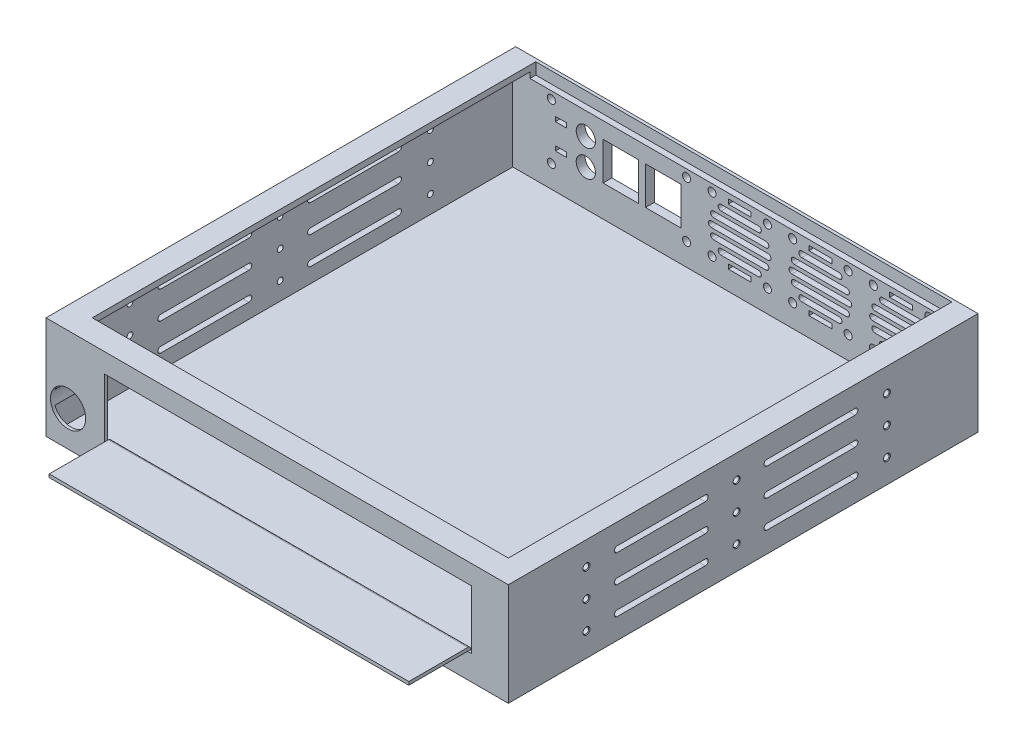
SolidWorks part; units mm, degrees
ref_plane "Front Plane" through (0, 0, 0) normal (0, 0, 1) x (1, 0, 0)
ref_plane "Top Plane" through (0, 0, 0) normal (0, 1, 0) x (1, 0, 0)
ref_plane "Right Plane" through (0, 0, 0) normal (1, 0, 0) x (0, 0, -1)
sketch "Sketch1" plane through (0, 0, 0) normal (0, 0, 1) x (1, 0, 0)
  line L1 (0, 0) -> (-200.025, 0)
  line L2 (0, 0) -> (0, -44.44)
  line L3 (0, -44.44) -> (-200.025, -44.44)
  line L4 (-200.025, 0) -> (-200.025, -44.44)
  dimension "D1" = 44.44
  dimension "D2" = 200.025
extrude "Boss-Extrude1" add sketch "Sketch1" along normal blind 203.2
sketch "Sketch2" plane through (0, 0, 0) normal (1, 0, 0) x (0, 0, -1)
  line L0 (-203.2, -44.44) -> (-203.2, 0) construction
  line L2 (-203.2, -22.22) -> (-38.4632, -22.22) construction
  line L3 (-53.213, -10.22) -> (-91.313, -10.22) construction
  line L4 (-53.213, -11.49) -> (-91.313, -11.49)
  line L5 (-53.213, -8.95) -> (-91.313, -8.95)
  line L6 (-53.213, -34.22) -> (-91.313, -34.22) construction
  line L7 (-53.213, -32.95) -> (-91.313, -32.95)
  line L8 (-53.213, -35.49) -> (-91.313, -35.49)
  line L9 (-117.983, -10.22) -> (-156.083, -10.22) construction
  line L10 (-117.983, -11.49) -> (-156.083, -11.49)
  line L11 (-117.983, -8.95) -> (-156.083, -8.95)
  line L12 (-117.983, -34.22) -> (-156.083, -34.22) construction
  line L13 (-117.983, -32.95) -> (-156.083, -32.95)
  line L14 (-117.983, -35.49) -> (-156.083, -35.49)
  line L15 (-53.213, -10.22) -> (-117.983, -10.22) construction
  line L16 (-53.213, -22.22) -> (-91.313, -22.22) construction
  line L17 (-53.213, -23.49) -> (-91.313, -23.49)
  line L18 (-53.213, -20.95) -> (-91.313, -20.95)
  line L25 (-117.983, -22.22) -> (-156.083, -22.22) construction
  line L26 (-117.983, -23.49) -> (-156.083, -23.49)
  line L27 (-117.983, -20.95) -> (-156.083, -20.95)
  line L70 (-182.753, -10.22) -> (-220.853, -10.22) construction
  line L71 (-182.753, -11.49) -> (-220.853, -11.49)
  line L72 (-182.753, -8.95) -> (-220.853, -8.95)
  line L73 (-182.753, -10.22) -> (-220.853, -10.22) construction
  line L74 (-182.753, -11.49) -> (-220.853, -11.49)
  line L75 (-182.753, -8.95) -> (-220.853, -8.95)
  arc A6 (-53.213, -11.49) -> (-53.213, -8.95) centre (-53.213, -10.22) ccw
  arc A7 (-91.313, -8.95) -> (-91.313, -11.49) centre (-91.313, -10.22) ccw
  arc A8 (-53.213, -32.95) -> (-53.213, -35.49) centre (-53.213, -34.22) cw
  arc A9 (-91.313, -35.49) -> (-91.313, -32.95) centre (-91.313, -34.22) cw
  arc A10 (-117.983, -11.49) -> (-117.983, -8.95) centre (-117.983, -10.22) ccw
  arc A11 (-156.083, -8.95) -> (-156.083, -11.49) centre (-156.083, -10.22) ccw
  arc A12 (-117.983, -32.95) -> (-117.983, -35.49) centre (-117.983, -34.22) cw
  arc A13 (-156.083, -35.49) -> (-156.083, -32.95) centre (-156.083, -34.22) cw
  arc A14 (-53.213, -23.49) -> (-53.213, -20.95) centre (-53.213, -22.22) ccw
  arc A15 (-91.313, -20.95) -> (-91.313, -23.49) centre (-91.313, -22.22) ccw
  arc A16 (-117.983, -23.49) -> (-117.983, -20.95) centre (-117.983, -22.22) ccw
  arc A17 (-156.083, -20.95) -> (-156.083, -23.49) centre (-156.083, -22.22) ccw
  arc A50 (-182.753, -11.49) -> (-182.753, -8.95) centre (-182.753, -10.22) ccw
  arc A51 (-220.853, -8.95) -> (-220.853, -11.49) centre (-220.853, -10.22) ccw
  point P0 (-39.418, -22.22)
  point P1 (-104.418, -22.22)
  point P2 (-169.418, -22.22)
  point P5 (-169.418, -34.22)
  point P8 (-104.418, -34.22)
  point P9 (-169.418, -10.22)
  point P16 (-104.418, -10.22)
  point P17 (-39.418, -10.22)
  point P20 (-72.263, -10.22)
  point P27 (-72.263, -34.22)
  point P36 (-137.033, -10.22)
  point P43 (-137.033, -34.22)
  point P50 (-201.803, -7.62)
  point P51 (-72.263, -22.22)
  point P55 (-39.418, -34.22)
  point P57 (-201.803, -7.62)
  point P64 (-201.803, -7.62)
  point P72 (-137.033, -22.22)
  point P81 (-201.803, -7.62)
  point P88 (-201.803, -7.62)
  point P95 (-201.803, -7.62)
  point P102 (-201.803, -9)
  point P109 (-201.803, -9)
  point P116 (-201.803, -8.57)
  point P123 (-201.803, -8.57)
  point P130 (-201.803, -8.57)
  point P137 (-201.803, -8.57)
  point P144 (-201.803, -8.57)
  point P151 (-201.803, -8.57)
  point P158 (-201.803, -10.22)
  point P165 (-201.803, -10.22)
  point P172 (-201.803, -10.22)
  point P179 (-201.803, -10.22)
  point P186 (-201.803, -10.22)
  dimension "D2" = 12
  dimension "D3" = 12
  dimension "D11" = 1.27
  dimension "D14" = 24
  dimension "D15" = 1.27
  dimension "D16" = 38.1
  dimension "D17" = 1.27
  dimension "D18" = 38.1
  dimension "D4" = 38.1
  dimension "D5" = 12
  dimension "D6" = 12
  dimension "D7" = 12
  dimension "D8" = 12
  dimension "D9" = 130
  dimension "D10" = 130
  dimension "D13" = 130
  dimension "D19" = 65
  dimension "D20" = 65
  dimension "D21" = 65
  dimension "D12" = 3
extrude "Cut-Extrude1" cut sketch "Sketch2" against normal through all
ref_plane "Plane1" through (0, 0, 201.93) normal (0, 0, 1) x (1, 0, 0)
sketch "Sketch4" plane through (0, 0, 201.93) normal (0, 0, 1) x (1, 0, 0)
  line L0 (-200.025, -44.44) -> (0, -44.44) construction
  line L1 (-2.54, -2.54) -> (-197.485, -2.54)
  line L2 (-2.54, -2.54) -> (-2.54, -41.9)
  line L3 (-2.54, -41.9) -> (-197.485, -41.9)
  line L4 (-197.485, -2.54) -> (-197.485, -41.9)
  line L5 (-200.025, 0) -> (-200.025, -44.44) construction
  line L6 (0, 0) -> (-200.025, 0) construction
  line L7 (0, -44.44) -> (0, 0) construction
  dimension "D1" = 2.54
  dimension "D2" = 2.54
  dimension "D3" = 2.54
  dimension "D4" = 2.54
extrude "Cut-Extrude2" cut sketch "Sketch4" against normal blind 198.12
sketch "Sketch5" plane through (0, 0, 203.2) normal (0, 0, 1) x (1, 0, 0)
  line L0 (0, 0) -> (-200.025, 0) construction
  line L1 (-15.875, -8.382) -> (-174.625, -8.382)
  line L2 (-15.875, -8.382) -> (-15.875, -33.782)
  line L3 (-15.875, -33.782) -> (-174.625, -33.782)
  line L4 (-174.625, -8.382) -> (-174.625, -33.782)
  line L6 (-200.025, 0) -> (-200.025, -44.44) construction
  line L8 (-200.025, -44.44) -> (0, -44.44) construction
  circle A0 centre (-190.4601, -29.2) radius 7.62
  point P8 (-200.025, -22.22)
  dimension "D5" = 15.24
  dimension "D1" = 8.382
  dimension "D2" = 25.4
  dimension "D3" = 158.75
  dimension "D4" = 25.4
  dimension "D6" = 15.24
extrude "Cut-Extrude3" cut sketch "Sketch5" against normal blind 25.4
ref_plane "Plane2" through (-17.653, 0, 0) normal (-1, 0, 0) x (0, 0, 1)
sketch "Sketch6" plane through (-17.653, 0, 0) normal (-1, 0, 0) x (0, 0, 1)
  line L0 (203.2, -33.782) -> (228.6, -33.782)
  line L1 (228.6, -33.782) -> (228.6, -32.385)
  line L2 (228.6, -32.385) -> (203.073, -32.385)
  line L3 (201.803, -33.655) -> (201.803, -33.782)
  line L4 (201.93, -33.782) -> (203.2, -33.782) construction
  line L5 (201.803, -33.782) -> (203.2, -33.782)
  arc A0 (203.073, -32.385) -> (201.803, -33.655) centre (203.073, -33.655) ccw
  point P11 (201.803, -32.385)
  dimension "D4" = 1.27
  dimension "D1" = 25.4
  dimension "D2" = 1.397
  dimension "D3" = 26.797
extrude "Boss-Extrude2" add sketch "Sketch6" along normal blind 155.575
sketch "Sketch9" plane through (0, 0, 0) normal (0, 0, -1) x (-1, 0, 0)
  line L0 (200.025, 0) -> (200.025, -44.44) construction
  line L1 (158.425, -12) -> (143.045, -12)
  line L2 (158.425, -12) -> (158.425, -28.38)
  line L3 (158.425, -28.38) -> (143.045, -28.38)
  line L4 (143.045, -12) -> (143.045, -28.38)
  line L5 (140.045, -12) -> (124.665, -12)
  line L6 (140.045, -12) -> (140.045, -28.38)
  line L7 (140.045, -28.38) -> (124.665, -28.38)
  line L8 (124.665, -12) -> (124.665, -28.38)
  line L9 (0, 0) -> (200.025, 0) construction
  line L10 (37.565, -12.09) -> (21.385, -12.09) construction
  line L11 (37.565, -13.34) -> (21.385, -13.34)
  line L12 (179.025, -13.7) -> (174.145, -13.7)
  line L13 (179.025, -13.7) -> (179.025, -15.7)
  line L14 (179.025, -15.7) -> (174.145, -15.7)
  line L15 (174.145, -13.7) -> (174.145, -15.7)
  line L16 (179.025, -24.7) -> (174.145, -24.7)
  line L17 (179.025, -24.7) -> (179.025, -26.7)
  line L18 (179.025, -26.7) -> (174.145, -26.7)
  line L19 (174.145, -24.7) -> (174.145, -26.7)
  line L20 (46.925, 0) -> (46.925, -44.44) construction
  line L21 (34.425, -7.2) -> (24.525, -7.2)
  line L22 (34.425, -7.2) -> (34.425, -9.2)
  line L23 (34.425, -9.2) -> (24.525, -9.2)
  line L24 (24.525, -7.2) -> (24.525, -9.2)
  line L25 (200.025, -44.44) -> (0, -44.44) construction
  line L26 (64.375, 0) -> (64.375, -44.44) construction
  line L27 (37.565, -10.84) -> (21.385, -10.84)
  line L28 (40.825, -16.23) -> (18.125, -16.23) construction
  line L29 (40.825, -17.48) -> (18.125, -17.48)
  line L30 (40.825, -14.98) -> (18.125, -14.98)
  line L31 (41.8, -20.37) -> (17.15, -20.37) construction
  line L32 (41.8, -21.62) -> (17.15, -21.62)
  line L33 (41.8, -19.12) -> (17.15, -19.12)
  line L34 (26.505, -20.37) -> (140.4774, -20.37) construction
  line L35 (37.565, -28.65) -> (21.385, -28.65) construction
  line L36 (37.565, -27.4) -> (21.385, -27.4)
  line L37 (37.565, -29.9) -> (21.385, -29.9)
  line L38 (40.825, -24.51) -> (18.125, -24.51) construction
  line L39 (40.825, -23.26) -> (18.125, -23.26)
  line L40 (40.825, -25.76) -> (18.125, -25.76)
  line L41 (34.425, -33.54) -> (34.425, -31.54)
  line L42 (34.425, -31.54) -> (24.525, -31.54)
  line L43 (24.525, -33.54) -> (24.525, -31.54)
  line L44 (34.425, -33.54) -> (24.525, -33.54)
  line L45 (69.325, -7.2) -> (69.325, -9.2)
  line L46 (59.425, -7.2) -> (69.325, -7.2)
  line L47 (59.425, -7.2) -> (59.425, -9.2)
  line L48 (59.425, -9.2) -> (69.325, -9.2)
  line L49 (56.285, -12.09) -> (72.465, -12.09) construction
  line L50 (56.285, -13.34) -> (72.465, -13.34)
  line L51 (56.285, -10.84) -> (72.465, -10.84)
  line L52 (53.025, -16.23) -> (75.725, -16.23) construction
  line L53 (53.025, -17.48) -> (75.725, -17.48)
  line L54 (53.025, -14.98) -> (75.725, -14.98)
  line L55 (52.05, -20.37) -> (76.7, -20.37) construction
  line L56 (52.05, -21.62) -> (76.7, -21.62)
  line L57 (52.05, -19.12) -> (76.7, -19.12)
  line L58 (53.025, -24.51) -> (75.725, -24.51) construction
  line L59 (53.025, -23.26) -> (75.725, -23.26)
  line L60 (53.025, -25.76) -> (75.725, -25.76)
  line L61 (56.285, -28.65) -> (72.465, -28.65) construction
  line L62 (56.285, -27.4) -> (72.465, -27.4)
  line L63 (56.285, -29.9) -> (72.465, -29.9)
  line L64 (59.425, -33.54) -> (59.425, -31.54)
  line L65 (69.325, -33.54) -> (69.325, -31.54)
  line L66 (59.425, -31.54) -> (69.325, -31.54)
  line L67 (59.425, -33.54) -> (69.325, -33.54)
  line L68 (104.225, -33.54) -> (104.225, -31.54)
  line L69 (94.325, -33.54) -> (94.325, -31.54)
  line L70 (94.325, -33.54) -> (104.225, -33.54)
  line L71 (94.325, -31.54) -> (104.225, -31.54)
  line L72 (91.185, -28.65) -> (107.365, -28.65) construction
  line L73 (91.185, -27.4) -> (107.365, -27.4)
  line L74 (91.185, -29.9) -> (107.365, -29.9)
  line L75 (87.925, -24.51) -> (110.625, -24.51) construction
  line L76 (87.925, -23.26) -> (110.625, -23.26)
  line L77 (87.925, -25.76) -> (110.625, -25.76)
  line L78 (86.95, -20.37) -> (111.6, -20.37) construction
  line L79 (86.95, -21.62) -> (111.6, -21.62)
  line L80 (86.95, -19.12) -> (111.6, -19.12)
  line L81 (87.925, -16.23) -> (110.625, -16.23) construction
  line L82 (87.925, -17.48) -> (110.625, -17.48)
  line L83 (87.925, -14.98) -> (110.625, -14.98)
  line L84 (91.185, -12.09) -> (107.365, -12.09) construction
  line L85 (91.185, -13.34) -> (107.365, -13.34)
  line L86 (91.185, -10.84) -> (107.365, -10.84)
  line L87 (94.325, -7.2) -> (94.325, -9.2)
  line L88 (94.325, -9.2) -> (104.225, -9.2)
  line L89 (104.225, -7.2) -> (104.225, -9.2)
  line L90 (94.325, -7.2) -> (104.225, -7.2)
  circle A0 centre (165.86, -14.595) radius 4.165
  circle A1 centre (165.86, -26.145) radius 4.165
  circle A2 centre (180.775, -8.2) radius 1.75
  circle A3 centre (180.775, -32.2) radius 1.75
  circle A4 centre (111.275, -8.2) radius 1.75
  circle A5 centre (111.275, -32.2) radius 1.75
  circle A6 centre (87.275, -8.2) radius 1.75
  circle A7 centre (87.275, -32.2) radius 1.75
  circle A8 centre (76.375, -8.2) radius 1.75
  circle A9 centre (76.375, -32.2005) radius 1.75
  circle A10 centre (52.375, -32.2) radius 1.75
  circle A11 centre (52.375, -8.2) radius 1.75
  circle A12 centre (41.475, -8.2) radius 1.75
  circle A13 centre (41.475, -32.2) radius 1.75
  circle A14 centre (17.475, -8.2) radius 1.75
  circle A15 centre (17.475, -32.2) radius 1.75
  arc A16 (37.565, -13.34) -> (37.565, -10.84) centre (37.565, -12.09) ccw
  arc A17 (21.385, -10.84) -> (21.385, -13.34) centre (21.385, -12.09) ccw
  arc A18 (40.825, -17.48) -> (40.825, -14.98) centre (40.825, -16.23) ccw
  arc A19 (18.125, -14.98) -> (18.125, -17.48) centre (18.125, -16.23) ccw
  arc A20 (41.8, -21.62) -> (41.8, -19.12) centre (41.8, -20.37) ccw
  arc A21 (17.15, -19.12) -> (17.15, -21.62) centre (17.15, -20.37) ccw
  arc A22 (37.565, -27.4) -> (37.565, -29.9) centre (37.565, -28.65) cw
  arc A23 (21.385, -29.9) -> (21.385, -27.4) centre (21.385, -28.65) cw
  arc A24 (40.825, -23.26) -> (40.825, -25.76) centre (40.825, -24.51) cw
  arc A25 (18.125, -25.76) -> (18.125, -23.26) centre (18.125, -24.51) cw
  arc A26 (56.285, -13.34) -> (56.285, -10.84) centre (56.285, -12.09) cw
  arc A27 (72.465, -10.84) -> (72.465, -13.34) centre (72.465, -12.09) cw
  arc A28 (53.025, -17.48) -> (53.025, -14.98) centre (53.025, -16.23) cw
  arc A29 (75.725, -14.98) -> (75.725, -17.48) centre (75.725, -16.23) cw
  arc A30 (52.05, -21.62) -> (52.05, -19.12) centre (52.05, -20.37) cw
  arc A31 (76.7, -19.12) -> (76.7, -21.62) centre (76.7, -20.37) cw
  arc A32 (53.025, -23.26) -> (53.025, -25.76) centre (53.025, -24.51) ccw
  arc A33 (75.725, -25.76) -> (75.725, -23.26) centre (75.725, -24.51) ccw
  arc A34 (56.285, -27.4) -> (56.285, -29.9) centre (56.285, -28.65) ccw
  arc A35 (72.465, -29.9) -> (72.465, -27.4) centre (72.465, -28.65) ccw
  arc A36 (91.185, -27.4) -> (91.185, -29.9) centre (91.185, -28.65) ccw
  arc A37 (107.365, -29.9) -> (107.365, -27.4) centre (107.365, -28.65) ccw
  arc A38 (87.925, -23.26) -> (87.925, -25.76) centre (87.925, -24.51) ccw
  arc A39 (110.625, -25.76) -> (110.625, -23.26) centre (110.625, -24.51) ccw
  arc A40 (86.95, -21.62) -> (86.95, -19.12) centre (86.95, -20.37) cw
  arc A41 (111.6, -19.12) -> (111.6, -21.62) centre (111.6, -20.37) cw
  arc A42 (87.925, -17.48) -> (87.925, -14.98) centre (87.925, -16.23) cw
  arc A43 (110.625, -14.98) -> (110.625, -17.48) centre (110.625, -16.23) cw
  arc A44 (91.185, -13.34) -> (91.185, -10.84) centre (91.185, -12.09) cw
  arc A45 (107.365, -10.84) -> (107.365, -13.34) centre (107.365, -12.09) cw
  circle A46 centre (122.275, -8.2) radius 1.75
  circle A47 centre (122.275, -32.2) radius 1.75
  point P64 (29.475, -12.09)
  point P71 (29.475, -16.23)
  point P78 (29.475, -20.37)
  point P87 (29.475, -28.65)
  point P94 (29.475, -24.51)
  point P109 (64.375, -12.09)
  point P116 (64.375, -16.23)
  point P123 (64.375, -20.37)
  point P130 (64.375, -24.51)
  point P137 (64.375, -28.65)
  point P152 (99.275, -28.65)
  point P159 (99.275, -24.51)
  point P166 (99.275, -20.37)
  point P173 (99.275, -16.23)
  point P180 (99.275, -12.09)
  dimension "D9" = 8.33
  dimension "D10" = 8.33
  dimension "D23" = 3.5
  dimension "D24" = 3.5
  dimension "D29" = 3.5
  dimension "D30" = 3.5
  dimension "D33" = 3.5
  dimension "D34" = 3.5
  dimension "D35" = 3.5
  dimension "D36" = 3.5
  dimension "D37" = 3.5
  dimension "D38" = 3.5
  dimension "D39" = 3.5
  dimension "D40" = 3.5
  dimension "D41" = 3.5
  dimension "D42" = 3.5
  dimension "D59" = 1.25
  dimension "D70" = 1.25
  dimension "D74" = 1.25
  dimension "D77" = 3.5
  dimension "D78" = 3.5
  dimension "D80" = 58.5
  dimension "D1" = 15.38
  dimension "D2" = 16.38
  dimension "D3" = 16.38
  dimension "D4" = 15.38
  dimension "D5" = 3
  dimension "D6" = 41.6
  dimension "D7" = 12
  dimension "D8" = 12
  dimension "D11" = 11.55
  dimension "D12" = 14.595
  dimension "D13" = 34.165
  dimension "D14" = 34.165
  dimension "D15" = 2
  dimension "D16" = 4.88
  dimension "D17" = 2
  dimension "D18" = 4.88
  dimension "D19" = 9
  dimension "D20" = 21
  dimension "D21" = 21
  dimension "D22" = 13.7
  dimension "D25" = 24
  dimension "D26" = 8.2
  dimension "D27" = 19.25
  dimension "D28" = 19.25
  dimension "D31" = 24
  dimension "D32" = 69.5
  dimension "D43" = 24
  dimension "D44" = 24
  dimension "D45" = 10.9
  dimension "D46" = 10.9
  dimension "D47" = 24
  dimension "D48" = 24
  dimension "D49" = 10.9
  dimension "D50" = 10.9
  dimension "D51" = 24
  dimension "D52" = 24
  dimension "D53" = 9.9
  dimension "D54" = 2
  dimension "D55" = 7.05
  dimension "D56" = 1
  dimension "D57" = 5.45
  dimension "D58" = 12
  dimension "D60" = 16.18
  dimension "D61" = 3.91
  dimension "D62" = 24
  dimension "D63" = 8.2
  dimension "D64" = 8.2
  dimension "D65" = 8.2
  dimension "D66" = 8.2
  dimension "D67" = 8.2
  dimension "D68" = 2.89
  dimension "D69" = 1.64
  dimension "D71" = 22.7
  dimension "D72" = 3.26
  dimension "D73" = 1.64
  dimension "D75" = 24.65
  dimension "D76" = 0.975
  dimension "D79" = 24
  dimension "D81" = 0
  dimension "D82" = 0
extrude "Cut-Extrude4" cut sketch "Sketch9" against normal blind 10
hole_wizard "M3 Tapped Hole1" positions "Sketch10" profile "Sketch11" tap size "M3" standard "DIN"
sketch "Sketch10" plane through (0, 0, 0) normal (1, 0, 0) x (0, 0, -1)
  point P0 (-39.418, -10.22)
  point P3 (-39.418, -22.22)
  point P6 (-39.418, -34.22)
  point P9 (-104.418, -34.22)
  point P12 (-104.418, -22.22)
  point P15 (-104.418, -10.22)
  point P18 (-169.418, -22.22)
  point P21 (-169.418, -10.22)
  point P24 (-169.418, -34.22)
sketch "Sketch11" plane through (0, -10.22, 39.418) normal (0, 1, 0) x (0, 0, -1)
  line L0 (0, 0) -> (0, 200.025)
  line L1 (0, 200.025) -> (1.25, 200.025)
  line L2 (1.25, 200.025) -> (1.25, 0.275)
  line L3 (1.25, 0.275) -> (1.525, 0)
  line L5 (1.525, 0) -> (0, 0)
  line L6 (-1.25, 0.275) -> (-1.525, 0) construction
  line L11 (0, -6.35) -> (0, 107.95) construction
  dimension "Thru Tap Drill Dia." = 2.5
  dimension "Thru Tap Drill Depth" = 200.025
  dimension "Near C'Sink Dia." = 3.05
  dimension "Near C'Sink Angle" = 90
ref_plane "Plane3" through (0, 0, 0) normal (0, 1, 0) x (1, 0, 0)
sketch "Sketch12" plane through (0, 0, 0) normal (0, 1, 0) x (1, 0, 0)
  line L0 (-200.025, -203.2) -> (-200.025, 0) construction
  line L1 (-13.9975, -1.6) -> (-198.425, -1.6)
  line L2 (-13.9975, -1.6) -> (-13.9975, -168.101)
  line L3 (-13.9975, -168.101) -> (-198.425, -168.101)
  line L4 (-198.425, -1.6) -> (-198.425, -168.101)
  line L5 (0, 0) -> (-200.025, 0) construction
  dimension "D1" = 1.6
  dimension "D2" = 1.6
ref_plane "Plane4" through (0, 0, 0) normal (0, 1, 0) x (1, 0, 0)
sketch "Sketch13" plane through (0, 0, 0) normal (0, 1, 0) x (1, 0, 0)
  line L0 (0, -203.2) -> (0, 0) construction
  line L1 (-10, -1.3) -> (-190.025, -1.3)
  line L2 (-10, -1.3) -> (-10, -193.2)
  line L3 (-10, -193.2) -> (-190.025, -193.2)
  line L4 (-190.025, -1.3) -> (-190.025, -193.2)
  line L5 (0, -203.2) -> (-200.025, -203.2) construction
  line L6 (-200.025, -203.2) -> (-200.025, 0) construction
  line L7 (0, 0) -> (-200.025, 0) construction
  dimension "D1" = 10
  dimension "D2" = 10
  dimension "D3" = 10
  dimension "D4" = 1.3
extrude "Cut-Extrude5" cut sketch "Sketch13" against normal blind 5
